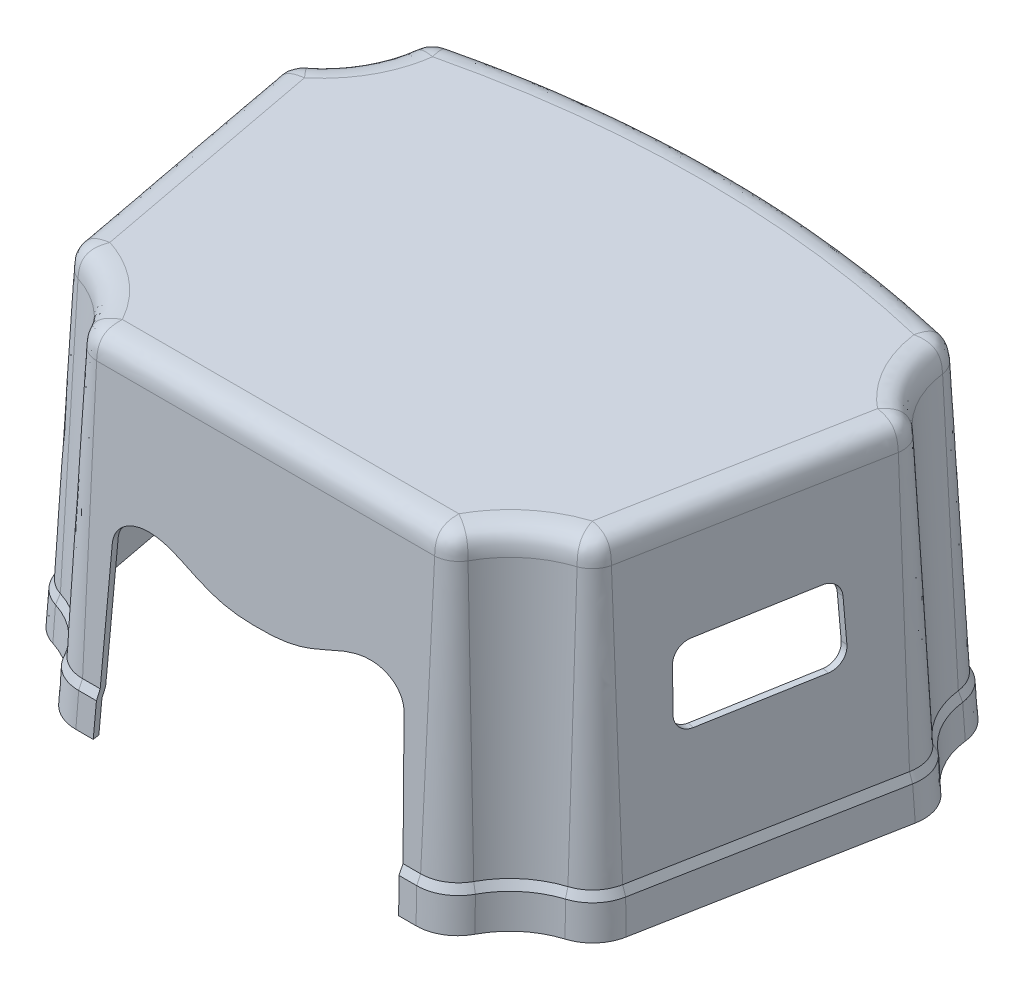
SolidWorks part; units mm, degrees
ref_plane "Front Plane" through (0, 0, 0) normal (0, 0, 1) x (1, 0, 0)
ref_plane "Top Plane" through (0, 0, 0) normal (0, 1, 0) x (1, 0, 0)
ref_plane "Right Plane" through (0, 0, 0) normal (1, 0, 0) x (0, 0, -1)
imported_body "Stock-05_0Pulls-1"
sketch "Sketch1" plane through (-12.0501, 114.629, -1.117) normal (0.1045, -0.9945, 0.0097) x (0.9945, 0.1045, -0.001)
  line L2 (-171.2254, -72.7906) -> (-166.0696, -72.0824)
  line L3 (-176.1978, -53.4753) -> (-178.3878, -64.925)
  line L4 (-171.2254, -72.7906) -> (-166.0696, -72.0824)
  line L5 (-176.1978, -53.4753) -> (-178.3878, -64.925)
  ellipse E2 centre (-209.1852, -115.3657) end of major axis (-266.1265, -120.673) minor radius 56.8711 (-171.2254, -72.7906) -> (-173.4131, -70.9569) ccw
  ellipse E3 centre (-209.1631, -115.3636) end of major axis (-270.1148, -121.0448) minor radius 60.8767 (-166.0696, -72.0824) -> (-170.8715, -67.8271) ccw
  ellipse E4 centre (-209.1852, -115.3657) end of major axis (-266.1265, -120.673) minor radius 56.8711 (-171.2254, -72.7906) -> (-173.4131, -70.9569) ccw
  ellipse E5 centre (-209.1631, -115.3636) end of major axis (-148.2113, -109.6825) minor radius 60.8767 (-166.0696, -72.0824) -> (-170.8715, -67.8271) ccw
  spline S2 degree 3 poles (-2128.694, 2198.8615) (25.3744, -24.4079) (-144.2316, -95.9288) (-172.8286, -65.9775) (-173.2552, -65.4642) (-174.0383, -64.3839) (-174.3943, -63.8165) (-175.0321, -62.625) (-175.3076, -62.0123) (-175.7718, -60.761) (-175.9611, -60.1213) (-176.2529, -58.8134) (-176.3553, -58.141) (-183.1915, 24.3107) (485.4997, 92.2207) (2814.8866, 126.0216) knots -7.465923 -7.465923 -7.465923 -7.465923 0.125 0.125 0.25 0.25 0.375 0.375 0.5 0.5 0.625 0.625 0.75 0.75 16.051144 16.051144 16.051144 16.051144 only from (-170.8715, -67.8271) to (-176.1978, -53.4753)
  spline S3 degree 3 poles (1734.8983, -2372.6799) (-141.5619, 71.9166) (-197.5773, -36.1791) (-177.0168, -67.1797) (-176.6268, -67.7052) (-117.7624, -139.0634) (444.9057, 235.2529) (2242.636, 1699.9967) knots -13.626859 -13.626859 -13.626859 -13.626859 0.25 0.25 0.5 0.5 35.695258 35.695258 35.695258 35.695258 only from (-178.3878, -64.925) to (-173.4131, -70.9569)
  spline S4 degree 3 poles (-170.8715, -67.8271) (-171.4004, -67.4058) (-171.9021, -66.9479) (-172.8286, -65.9775) (-173.2552, -65.4642) (-174.0383, -64.3839) (-174.3943, -63.8165) (-175.0321, -62.625) (-175.3076, -62.0123) (-175.7718, -60.761) (-175.9611, -60.1213) (-176.2529, -58.8134) (-176.3553, -58.141) (-176.5215, -56.1366) (-176.452, -54.8041) (-176.1978, -53.4753) knots 0 0 0 0 0.125 0.125 0.25 0.25 0.375 0.375 0.5 0.5 0.625 0.625 0.75 0.75 1 1 1 1
  spline S5 degree 3 poles (-178.3878, -64.925) (-178.0836, -65.5087) (-177.7445, -66.0825) (-177.0168, -67.1797) (-176.6268, -67.7052) (-175.3812, -69.2151) (-174.4491, -70.1319) (-173.4131, -70.9569) knots 0 0 0 0 0.25 0.25 0.5 0.5 1 1 1 1
  dimension "D1" = 0
sketch "Sketch2" plane through (-0.1633, 89.4487, 0.8668) normal (-0.0018, 1, 0.0097) x (1, 0.0018, 0)
  line L2 (-189.6044, 66.7681) -> (-187.4309, 55.2176)
  line L3 (-177.2355, 74.2034) -> (-182.3428, 74.8806)
  line L4 (-189.6044, 66.7681) -> (-187.4309, 55.2176)
  line L5 (-177.2355, 74.2034) -> (-182.3428, 74.8806)
  ellipse E2 centre (-220.2341, 117.1904) end of major axis (-230.7501, 61.3739) minor radius 56.7957 (-184.5474, 73.005) -> (-182.3428, 74.8806) ccw
  ellipse E3 centre (-220.2337, 117.1924) end of major axis (-208.9761, 176.9454) minor radius 60.8012 (-182.0302, 69.8909) -> (-177.2355, 74.2034) ccw
  ellipse E4 centre (-220.2341, 117.1904) end of major axis (-209.7181, 173.0069) minor radius 56.7957 (-184.5474, 73.005) -> (-182.3428, 74.8806) ccw
  ellipse E5 centre (-220.2337, 117.1924) end of major axis (-208.9761, 176.9454) minor radius 60.8012 (-182.0302, 69.8909) -> (-177.2355, 74.2034) ccw
  spline S2 degree 3 poles (2227.4938, -1702.9244) (468.2922, -259.0189) (-127.0227, 144.6284) (-187.8228, 69.6382) (-188.2195, 69.0936) (-188.774, 68.2405) (-188.9523, 67.9499) (-242.7328, -25.1094) (550.6493, -449.4892) (-3069.4967, 854.1088) knots -35.208341 -35.208341 -35.208341 -35.208341 0.5 0.5 0.75 0.75 0.875 0.875 40.453669 40.453669 40.453669 40.453669 only from (-184.5474, 73.005) to (-189.6044, 66.7681)
  spline S3 degree 3 poles (274.8863, 3013.4425) (-9.3472, -43.8957) (-185.5611, 15.5687) (-187.7091, 57.9495) (-187.6978, 58.6303) (-187.5842, 59.9882) (-187.4815, 60.6666) (-187.1826, 62.0133) (-186.9893, 62.6689) (-186.5184, 63.9462) (-186.2409, 64.5678) (-185.6002, 65.7764) (-185.2341, 66.3667) (-135.7251, 135.3181) (428.0609, -254.745) (2212.0784, -1731.7554) knots -7.508253 -7.508253 -7.508253 -7.508253 0.125 0.125 0.25 0.25 0.375 0.375 0.5 0.5 0.625 0.625 0.75 0.75 16.134493 16.134493 16.134493 16.134493 only from (-187.4309, 55.2176) to (-182.0302, 69.8909)
  spline S4 degree 3 poles (-184.5474, 73.005) (-185.6043, 72.1513) (-186.5546, 71.2023) (-187.8228, 69.6382) (-188.2195, 69.0936) (-188.774, 68.2405) (-188.9523, 67.9499) (-189.2909, 67.3639) (-189.4518, 67.0676) (-189.6044, 66.7681) knots 0 0 0 0 0.5 0.5 0.75 0.75 0.875 0.875 1 1 1 1
  spline S5 degree 3 poles (-187.4309, 55.2176) (-187.5586, 55.8962) (-187.6399, 56.5838) (-187.7091, 57.9495) (-187.6978, 58.6303) (-187.5842, 59.9882) (-187.4815, 60.6666) (-187.1826, 62.0133) (-186.9893, 62.6689) (-186.5184, 63.9462) (-186.2409, 64.5678) (-185.6002, 65.7764) (-185.2341, 66.3667) (-184.0371, 68.0339) (-183.1031, 69.0243) (-182.0302, 69.8909) knots 0 0 0 0 0.125 0.125 0.25 0.25 0.375 0.375 0.5 0.5 0.625 0.625 0.75 0.75 1 1 1 1
  dimension "D1" = 0
loft "Loft1" add profiles "Sketch2", "Sketch1"
